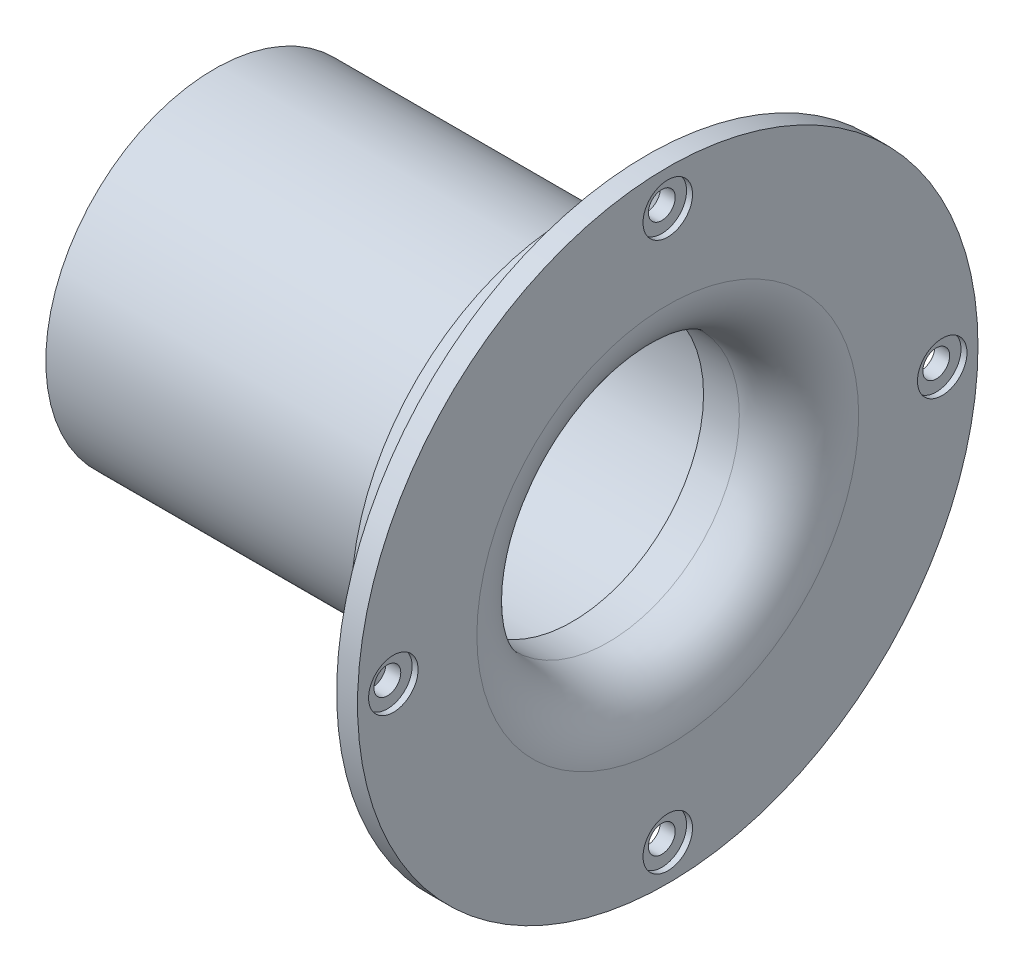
SolidWorks part; units mm, degrees
ref_plane "Спереди" through (0, 0, 0) normal (0, 0, 1) x (1, 0, 0)
ref_plane "Сверху" through (0, 0, 0) normal (0, 1, 0) x (1, 0, 0)
ref_plane "Справа" through (0, 0, 0) normal (1, 0, 0) x (0, 0, -1)
sketch "Эскиз1" plane through (0, 0, 0) normal (0, 1, 0) x (1, 0, 0)
  line L0 (0, 0) -> (-127.0527, 0) construction
  line L1 (-76, 28.25) -> (-16, 28.25)
  line L2 (-3.5, 52) -> (-3.5, 37)
  line L4 (-16, 25.25) -> (-16, 22)
  line L5 (-76, 25.25) -> (-16, 25.25)
  line L6 (-16, 37) -> (-3.5, 37)
  line L7 (0, 52) -> (-3.5, 52)
  line L10 (-76, 28.25) -> (-76, 25.25)
  line L11 (-16, 22) -> (-10, 22)
  line L12 (0, 52) -> (0, 32)
  line L15 (-16, 28.25) -> (-16, 37)
  arc A0 (0, 32) -> (-10, 22) centre (-10, 32) cw
  point P13 (-3, 78.3746)
  point P21 (0, 78.3746)
  point P22 (-3, 32)
  dimension "D1" = 10
  dimension "D2" = 16
revolve "Повернуть1" add sketch "Эскиз1" angle 360 about L0
sketch "Эскиз2" plane through (0, 0, 0) normal (1, 0, 0) x (0, 0, -1)
  circle A1 centre (-46, 0) radius 2.25
  circle A2 centre (0, 46) radius 2.25
  circle A3 centre (46, 0) radius 2.25
  circle A4 centre (0, -46) radius 2.25
  dimension "D2" = 4
extrude "Вырез-Вытянуть1" cut sketch "Эскиз2" against normal blind 3.5
sketch "Эскиз3" plane through (0, 0, 0) normal (1, 0, 0) x (0, 0, -1)
  circle A0 centre (-46, 0) radius 4.15
  circle A1 centre (0, 46) radius 4.15
  circle A2 centre (46, 0) radius 4.15
  circle A3 centre (0, -46) radius 4.15
  dimension "D1" = 8.3
  dimension "D2" = 4
extrude "Вырез-Вытянуть2" cut sketch "Эскиз3" against normal blind 1
